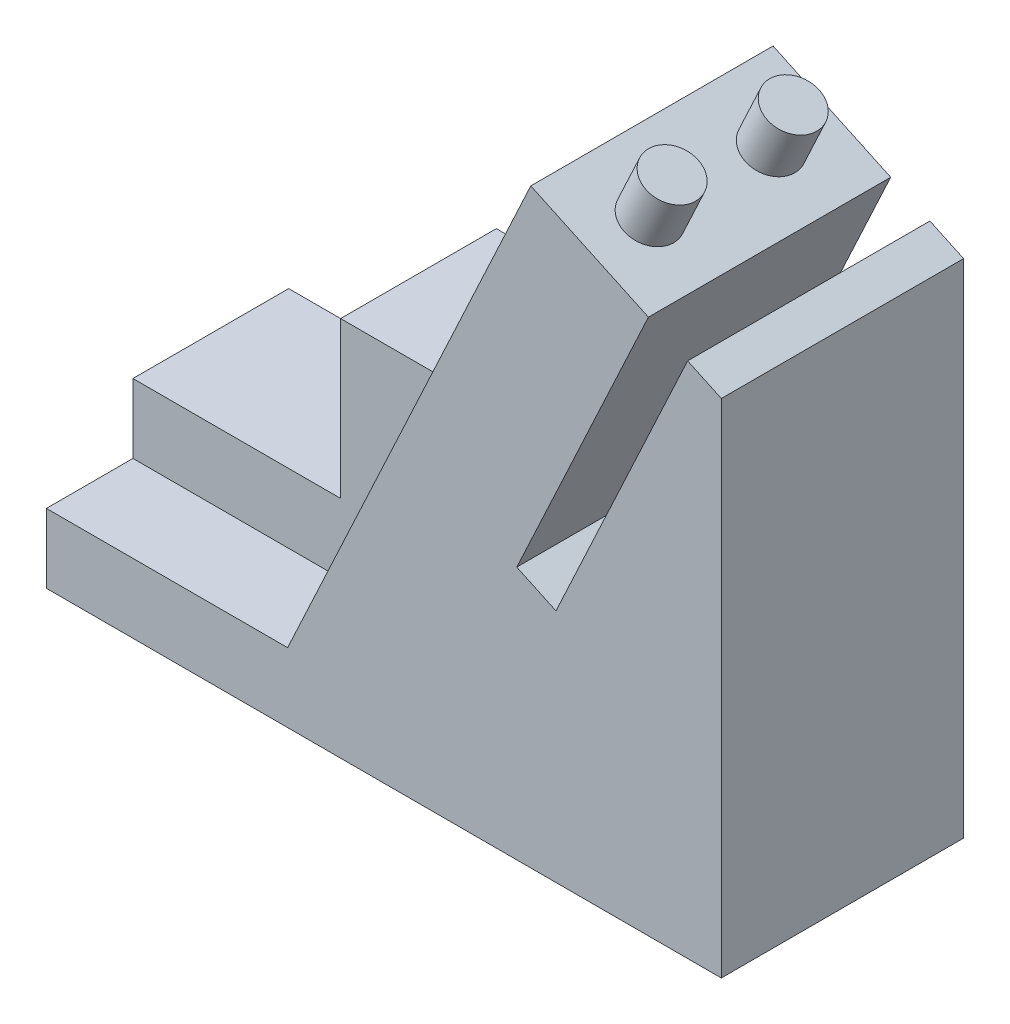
SolidWorks part; units mm, degrees
ref_plane "Alzado" through (0, 0, 0) normal (0, 0, 1) x (1, 0, 0)
ref_plane "Planta" through (0, 0, 0) normal (0, 1, 0) x (1, 0, 0)
ref_plane "Vista lateral" through (0, 0, 0) normal (1, 0, 0) x (0, 0, -1)
sketch "Sketch1" plane through (0, 0, 0) normal (0, 0, 1) x (1, 0, 0)
  line L0 (0, 0) -> (78, 0)
  line L1 (78, 0) -> (78, 58)
  line L2 (78, 58) -> (55.9796, 68.2683)
  line L3 (55.9796, 68.2683) -> (40, 34)
  line L4 (40, 34) -> (24, 34)
  line L5 (24, 34) -> (24, 16)
  line L6 (24, 16) -> (0, 16)
  line L7 (0, 16) -> (0, 0)
  dimension "D1" = 78
  dimension "D2" = 58
  dimension "D3" = 16
  dimension "D4" = 18
  dimension "D5" = 16
  dimension "D6" = 24
  dimension "D7" = 65
extrude "Boss-Extrude1" add sketch "Sketch1" along normal blind 28
sketch "Sketch2" plane through (0, 0, 28) normal (0, 0, 1) x (1, 0, 0)
  line L0 (69.5742, 61.929) -> (54.3599, 29.3019)
  line L1 (78, 58) -> (55.9796, 68.2683) construction
  line L2 (55.9796, 68.2683) -> (40, 34) construction
  line L3 (54.3599, 29.3019) -> (54.3235, 29.3189)
  line L4 (54.3599, 29.3019) -> (58.8915, 27.1889)
  line L5 (58.8915, 27.1889) -> (74.1057, 59.8159)
  line L6 (74.1057, 59.8159) -> (69.5742, 61.929)
  dimension "D1" = 36
  dimension "D2" = 15
  dimension "D3" = 5
extrude "Cut-Extrude1" cut sketch "Sketch2" against normal up to next contours L4 L5 L0 M9
sketch "Sketch3" plane through (0, 0, 28) normal (0, 0, 1) x (1, 0, 0)
  line L0 (0, 8) -> (27.876, 8)
  line L1 (0, 16) -> (0, 0) construction
  line L2 (27.876, 8) -> (40, 34)
  line L3 (0, 0) -> (78, 0) construction
  line L4 (0, 8) -> (0, 16)
  line L5 (0, 16) -> (24, 16)
  line L6 (24, 16) -> (24, 34)
  line L7 (24, 34) -> (40, 34)
  dimension "D1" = 8
  dimension "D2" = 65
extrude "Cut-Extrude2" cut sketch "Sketch3" against normal blind 10
sketch "Sketch4" plane through (36.1466, 77.5166, 0) normal (0.4226, 0.9063, 0) x (0.9063, -0.4226, 0)
  line L0 (21.8833, -18) -> (21.8833, 0) construction
  line L1 (36.8833, 0) -> (21.8833, 0) construction
  line L2 (36.8833, -28) -> (21.8833, -28) construction
  line L3 (21.8833, -18) -> (21.8833, -28) construction
  circle A0 centre (29.3833, -7) radius 3
  circle A1 centre (29.3833, -21) radius 3
  dimension "D1" = 6
  dimension "D2" = 6
  dimension "D3" = 7.5
  dimension "D4" = 7
  dimension "D5" = 7
  dimension "7.5" = 7.5
extrude "Boss-Extrude2" add sketch "Sketch4" along normal blind 6
